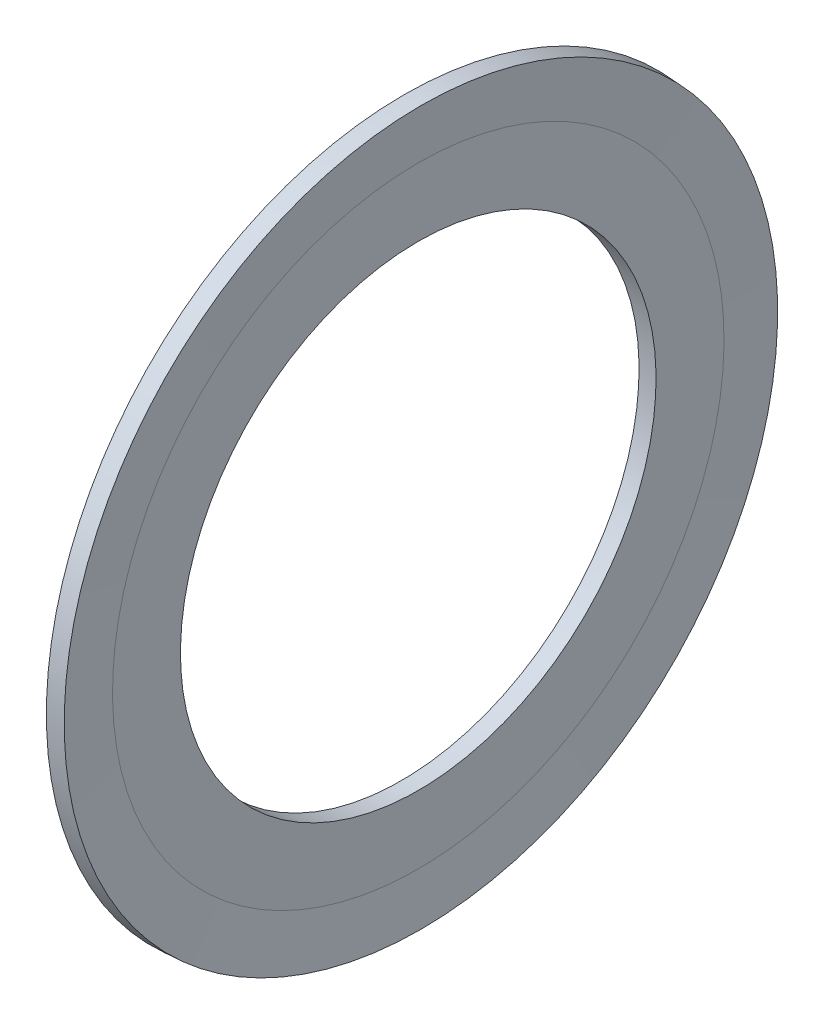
SolidWorks part; units mm, degrees
ref_plane "Plan1" through (0, 0, 0) normal (0, 0, 1) x (1, 0, 0)
ref_plane "Plan2" through (0, 0, 0) normal (0, 1, 0) x (1, 0, 0)
ref_plane "Plan3" through (0, 0, 0) normal (1, 0, 0) x (0, 0, -1)
sketch "Esquisse1" plane through (0, 0, 0) normal (0, 0, 1) x (1, 0, 0)
  line L0 (0, 14) -> (0, 18)
  line L2 (0, 18) -> (0.1572, 21)
  line L3 (0.1572, 21) -> (-0.8414, 21.0523)
  line L4 (-0.8414, 21.0523) -> (-1, 18.0262)
  line L5 (-1, 18.0262) -> (-1, 14)
  line L7 (-1, 14) -> (0, 14)
  line L8 (20, 0) -> (-40, 0) construction
  dimension "D1" = 28
  dimension "D2" = 42
  dimension "D3" = 36
  dimension "D4" = 1
  dimension "D5" = 1
  dimension "D6" = 3
revolve "Base-Révolution" add sketch "Esquisse1" angle 360 about L8
